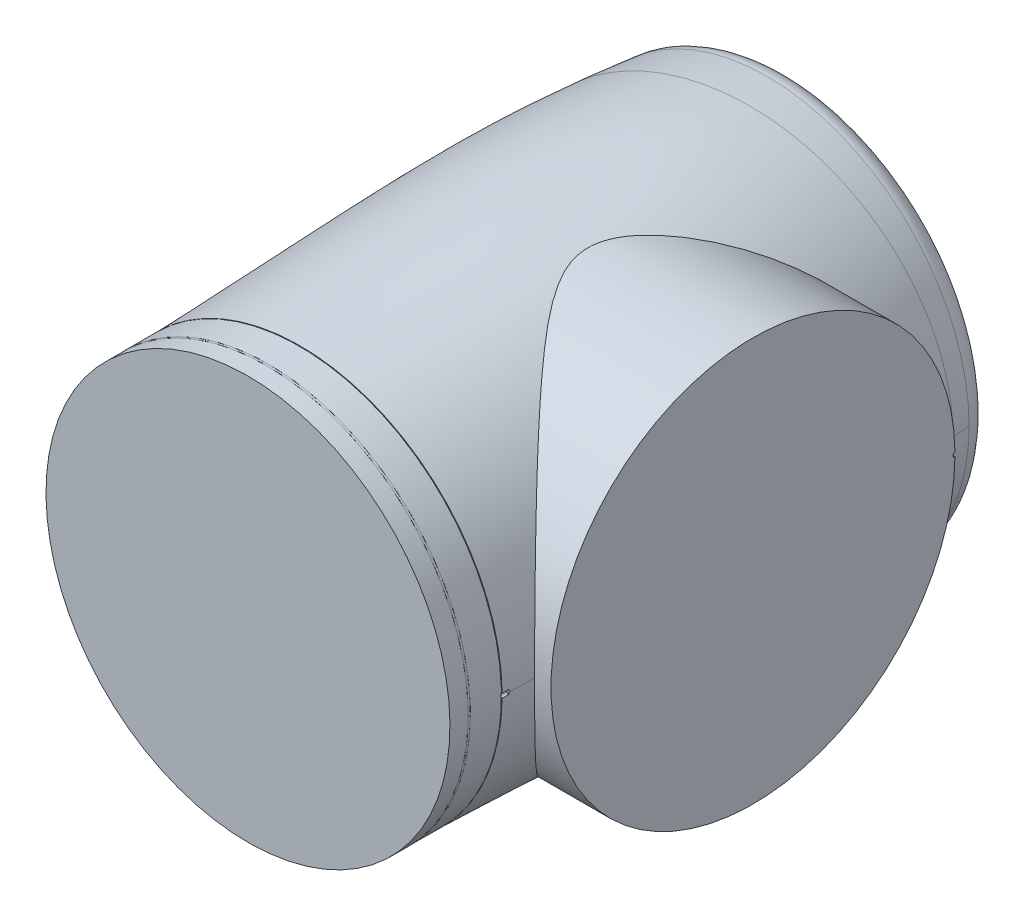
SolidWorks part; units mm, degrees
ref_plane "前视基准面" through (0, 0, 0) normal (0, 0, 1) x (1, 0, 0)
ref_plane "上视基准面" through (0, 0, 0) normal (0, 1, 0) x (1, 0, 0)
ref_plane "右视基准面" through (0, 0, 0) normal (1, 0, 0) x (0, 0, -1)
imported_body "输入1"
sketch "草图1" plane through (0, 0, 0) normal (0, 1, 0) x (1, 0, 0)
  line L0 (29.4448, -365.5274) -> (29.2762, -365.5274)
  line L2 (29.4448, -374.0274) -> (29.4448, -350.3274) construction
  line L3 (29.2762, -365.5274) -> (29.2762, -365.5074)
  line L4 (29.2762, -365.5074) -> (29.4448, -365.5074)
  line L5 (29.4448, -365.5074) -> (29.4448, -365.5274)
  line L6 (-153.3864, -374.0274) -> (29.4448, -374.0274) construction
  line L7 (-61.9708, -374.0274) -> (-61.9708, -323.9234) construction
  line L8 (29.4448, -364.5474) -> (29.2568, -364.5474)
  line L9 (29.4448, -364.5474) -> (29.4448, -364.5274)
  line L10 (29.4448, -364.5274) -> (29.2568, -364.5274)
  line L11 (29.2568, -364.5474) -> (29.2568, -364.5274)
  dimension "D1" = 8.5
  dimension "D2" = 0.02
  dimension "D3" = 0.02
  dimension "D4" = 1
revolve "切除-旋转1" [suppressed] cut sketch "草图1" angle 360 about L7
sketch "草图2" plane through (0, 0, 374.0274) normal (0, 0, 1) x (1, 0, 0)
  line L0 (-156.5552, 18.2438) -> (29.4448, 18.2438) construction
  circle A0 centre (-63.5552, 18.2438) radius 93
ref_plane "基准面1" through (0, 18.2438, 0) normal (0, -1, 0) x (1, 0, 0)
sketch "草图3" plane through (0, 18.2438, 0) normal (0, -1, 0) x (1, 0, 0)
  line L0 (-156.5552, 374.0274) -> (29.4448, 374.0274) construction
  line L1 (28.8885, 365.6274) -> (29.9215, 365.6274)
  line L2 (28.8885, 365.6274) -> (28.8885, 365.6074)
  line L3 (28.8885, 365.6074) -> (29.9215, 365.6074)
  line L4 (29.9215, 365.6274) -> (29.9215, 365.6074)
  line L5 (28.9007, 364.6474) -> (29.9337, 364.6474)
  line L6 (28.9007, 364.6474) -> (28.9007, 364.6274)
  line L7 (28.9007, 364.6274) -> (29.9337, 364.6274)
  line L8 (29.9337, 364.6474) -> (29.9337, 364.6274)
  line L9 (-63.5552, 374.0274) -> (-63.5552, 96.6209) construction
  dimension "D1" = 8.4
  dimension "D2" = 0.02
  dimension "D3" = 0.02
  dimension "D4" = 1
revolve "切除-旋转2" cut sketch "草图3" angle 360 about L9
sketch "草图4" plane through (37.4448, 0, 0) normal (1, 0, 0) x (0, 0, -1)
  circle A0 centre (-149.5274, 18.2438) radius 1
  dimension "D1" = 2
extrude "切除-拉伸1" cut sketch "草图4" against normal blind 3
sketch "草图5" plane through (0, 0, 350.0274) normal (0, 0, 1) x (1, 0, 0)
  circle A0 centre (29.4448, 18.2438) radius 1
  dimension "D1" = 2
extrude "切除-拉伸2" cut sketch "草图5" against normal blind 3
